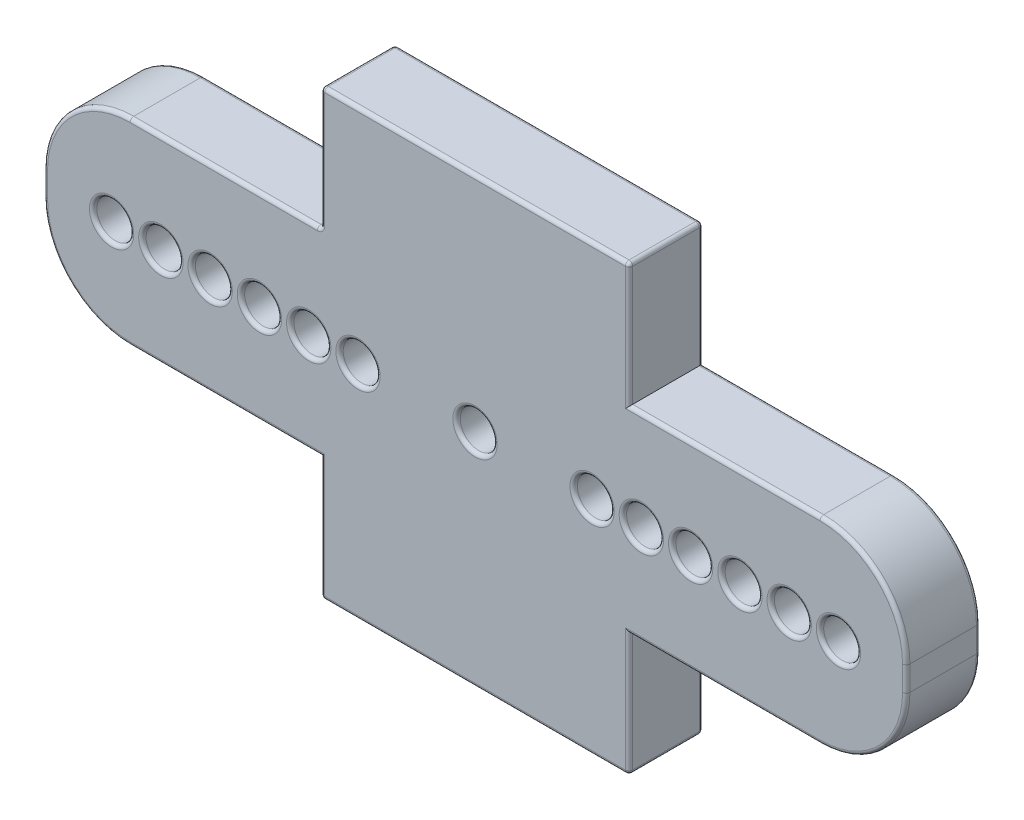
SolidWorks part; units mm, degrees
ref_plane "Front Plane" through (0, 0, 0) normal (0, 0, 1) x (1, 0, 0)
ref_plane "Top Plane" through (0, 0, 0) normal (0, 1, 0) x (1, 0, 0)
ref_plane "Right Plane" through (0, 0, 0) normal (1, 0, 0) x (0, 0, -1)
sketch "Sketch1" plane through (0, 0, 0) normal (0, 0, 1) x (1, 0, 0)
  line L0 (-17.5, 0.5) -> (-17.5, -0.5)
  line L1 (6.25, -9) -> (-6.25, -9) construction
  line L2 (6.25, -9) -> (6.25, 9) construction
  line L3 (6.25, 9) -> (-6.25, 9) construction
  line L4 (-6.25, -9) -> (-6.25, 9) construction
  line L5 (6.25, -9) -> (-6.25, 9) construction
  line L6 (6.25, 9) -> (-6.25, -9) construction
  line L7 (17.5, -4) -> (-17.5, -4) construction
  line L8 (17.5, -4) -> (17.5, 4) construction
  line L9 (17.5, 4) -> (-17.5, 4) construction
  line L10 (-17.5, -4) -> (-17.5, 4) construction
  line L11 (17.5, -4) -> (-17.5, 4) construction
  line L12 (17.5, 4) -> (-17.5, -4) construction
  line L13 (-14, -4) -> (-6.25, -4)
  line L14 (-6.25, -4) -> (-6.25, -9)
  line L15 (-6.25, -9) -> (6.25, -9)
  line L16 (6.25, -9) -> (6.25, -4)
  line L17 (6.25, -4) -> (14, -4)
  line L18 (17.5, -0.5) -> (17.5, 0.5)
  line L19 (14, 4) -> (6.25, 4)
  line L20 (6.25, 4) -> (6.25, 9)
  line L21 (6.25, 9) -> (-6.25, 9)
  line L22 (-6.25, 9) -> (-6.25, 4)
  line L23 (-6.25, 4) -> (-14, 4)
  circle A0 centre (0, 0) radius 0.75
  arc A1 (-14, 4) -> (-17.5, 0.5) centre (-14, 0.5) ccw
  arc A2 (-17.5, -0.5) -> (-14, -4) centre (-14, -0.5) ccw
  arc A3 (14, -4) -> (17.5, -0.5) centre (14, -0.5) ccw
  arc A4 (17.5, 0.5) -> (14, 4) centre (14, 0.5) ccw
  point P0 (0, 0)
  point P6 (0, 0)
  dimension "D5" = 1.5
  dimension "D6" = 3.5
  dimension "D1" = 8
  dimension "D2" = 35
  dimension "D3" = 12.5
  dimension "D4" = 18
extrude "Boss-Extrude2" add sketch "Sketch1" along normal mid plane 3
sketch "Sketch2" plane through (0, 0, 1.5) normal (0, 0, 1) x (1, 0, 0)
  line L0 (-17.5, 0) -> (17.5, 0) construction
  line L1 (-17.5, 0.5) -> (-17.5, -0.5) construction
  line L2 (17.5, -0.5) -> (17.5, 0.5) construction
  line L5 (6.25, -9) -> (6.25, -4) construction
  line L6 (-6.25, -9) -> (6.25, -9) construction
  circle A0 centre (-14.75, 0) radius 0.75
  circle A1 centre (-12.75, 0) radius 0.75
  circle A2 centre (-10.75, 0) radius 0.75
  circle A3 centre (-8.75, 0) radius 0.75
  circle A4 centre (-6.75, 0) radius 0.75
  circle A5 centre (-4.75, 0) radius 0.75
  point P7 (-4.75, 0)
  point P8 (-6.75, 0)
  point P9 (-8.75, 0)
  point P10 (-10.75, 0)
  point P11 (-12.75, 0)
  point P12 (-14.75, 0)
  dimension "D8" = 1.5
  dimension "D1" = 4.75
  dimension "D2" = 2.75
  dimension "D7" = 6
extrude "Cut-Extrude1" cut sketch "Sketch2" against normal up to next
mirror "Mirror1" about plane through (0, 0, 0) normal (1, 0, 0) of "Cut-Extrude1"
fillet "Fillet2" radius 0.15 63 edges at (4, 0, 1.5) (5.5, 0, -1.5) (6, 0, 1.5) (7.5, 0, -1.5) (8, 0, 1.5) (9.5, 0, -1.5) (10, 0, 1.5) (11.5, 0, -1.5) (12, 0, 1.5) (13.5, 0, -1.5) (14, 0, 1.5) (15.5, 0, -1.5) (-4, 0, -1.5) (-4, 0, 1.5) (-6, 0, -1.5) (-6, 0, 1.5) (-8, 0, -1.5) (-8, 0, 1.5) (-10, 0, -1.5) (-10, 0, 1.5) (-12, 0, -1.5) (-12, 0, 1.5) (-14, 0, -1.5) (-14, 0, 1.5) (0.75, 0, -1.5) (0.75, 0, 1.5) (-6.25, 6.5, -1.5) (-10.125, 4, -1.5) (-17.5, 0, -1.5) (-10.125, -4, -1.5) (-6.25, -6.5, -1.5) (0, -9, -1.5) (6.25, -6.5, -1.5) (10.125, -4, -1.5) (17.5, 0, -1.5) (10.125, 4, -1.5) (6.25, 6.5, -1.5) (0, 9, -1.5) (-10.125, 4, 1.5) (-17.5, 0, 1.5) (-10.125, -4, 1.5) (-6.25, -6.5, 1.5) (0, -9, 1.5) (6.25, -6.5, 1.5) (10.125, -4, 1.5) (17.5, 0, 1.5) (10.125, 4, 1.5) (6.25, 6.5, 1.5) (0, 9, 1.5) (-6.25, 9, 0) (6.25, 9, 0) (6.25, -9, 0) (-6.25, -9, 0) (-6.25, 6.5, 1.5) (-6.25, 4, 0) (-16.4749, 2.9749, -1.5) (-16.4749, -2.9749, -1.5) (16.4749, -2.9749, -1.5) (16.4749, 2.9749, -1.5) (-16.4749, 2.9749, 1.5) (-16.4749, -2.9749, 1.5) (16.4749, -2.9749, 1.5) (16.4749, 2.9749, 1.5)
